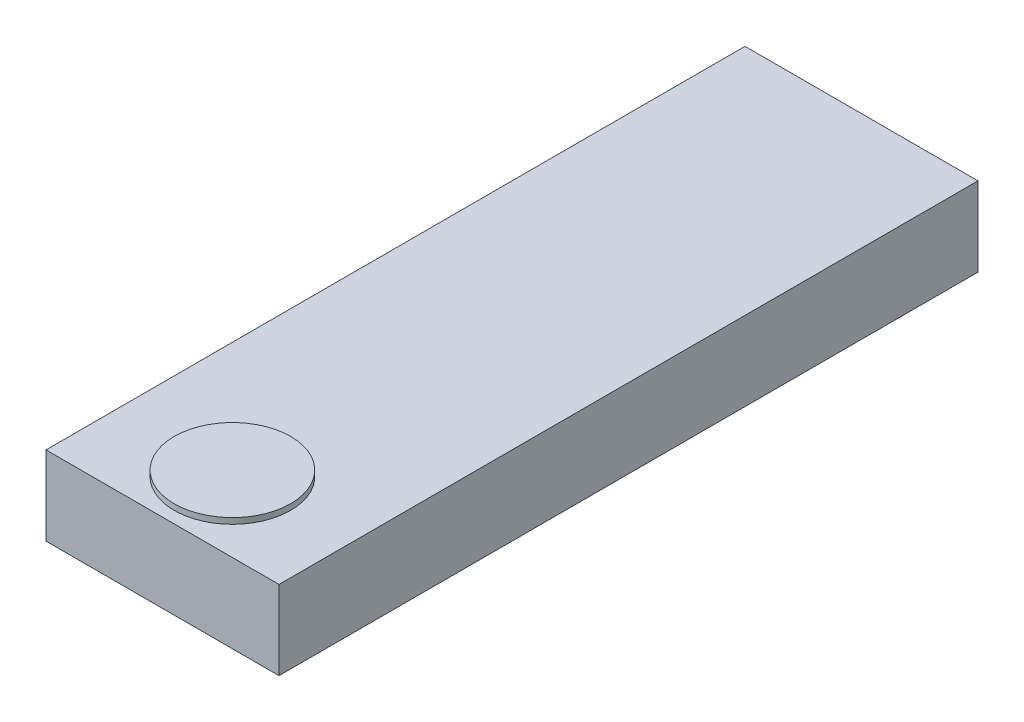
SolidWorks part; units mm, degrees
ref_plane "Front Plane" through (0, 0, 0) normal (0, 0, 1) x (1, 0, 0)
ref_plane "Top Plane" through (0, 0, 0) normal (0, 1, 0) x (1, 0, 0)
ref_plane "Right Plane" through (0, 0, 0) normal (1, 0, 0) x (0, 0, -1)
sketch "Sketch1" plane through (0, 0, 0) normal (0, 0, 1) x (1, 0, 0)
  line L1 (-25.4, 0) -> (25.4, 0)
  line L2 (-25.4, 0) -> (-25.4, -17.233)
  line L3 (-25.4, -17.233) -> (25.4, -17.233)
  line L4 (25.4, 0) -> (25.4, -17.233)
  dimension "D1" = 50.8
  dimension "D2" = 17.233
extrude "Boss-Extrude1" add sketch "Sketch1" along normal blind 152.4
sketch "Sketch2" plane through (0, 0, 0) normal (0, 1, 0) x (1, 0, 0)
  line L0 (0, 0) -> (0, -137.16) construction
  line L1 (25.4, -152.4) -> (-25.4, -152.4) construction
  circle A0 centre (0, -137.16) radius 12.7
  dimension "D1" = 25.4
  dimension "D2" = 15.24
extrude "Boss-Extrude2" add sketch "Sketch2" along normal blind 1.27
